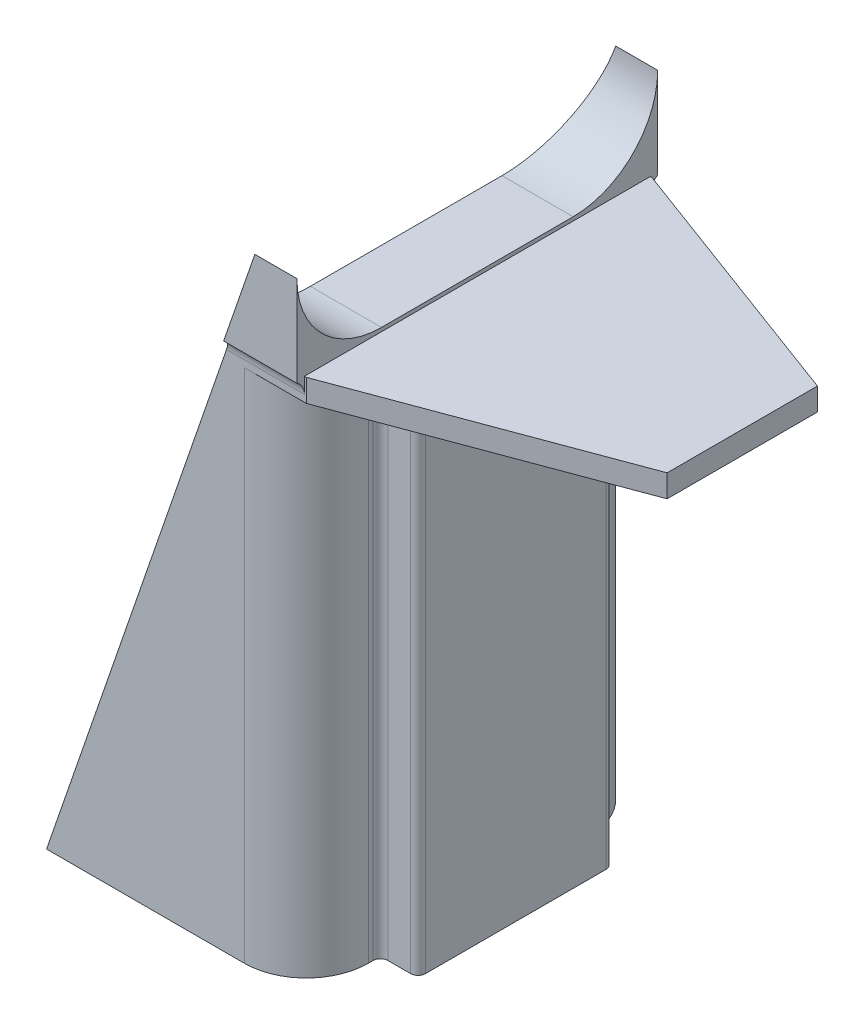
SolidWorks part; units mm, degrees
ref_plane "Alzado" through (0, 0, 0) normal (0, 0, 1) x (1, 0, 0)
ref_plane "Planta" through (0, 0, 0) normal (0, 1, 0) x (1, 0, 0)
ref_plane "Vista lateral" through (0, 0, 0) normal (1, 0, 0) x (0, 0, -1)
sketch "Croquis1" plane through (0, 0, 0) normal (0, 1, 0) x (1, 0, 0)
  line L12 (-39.5, 46) -> (39.5139, 46)
  line L13 (56, 28.8233) -> (56, 27.7301)
  line L14 (39.5, -46) -> (-39.5, -46)
  line L16 (-39.5, -46) -> (-39.5, -40)
  line L17 (-39.5, 40) -> (-39.5, 46)
  line L19 (50, -0.2699) -> (143.2716, -0.2699) construction
  line L20 (39.5, -40) -> (-39.5, -40)
  line L21 (132.78, -20.2699) -> (30.5649, -20.2699) construction
  line L23 (50, -29.5) -> (50, -20.2699)
  line L24 (132.78, 19.7301) -> (94.3511, 19.7301) construction
  line L25 (50, 19.7301) -> (50, -20.2699) construction
  line L26 (50, -20.2699) -> (60, -20.2699) construction
  line L27 (60, -20.2699) -> (60, 19.7301) construction
  line L28 (60, 19.7301) -> (50, 19.7301) construction
  line L29 (96.8866, 25.7301) -> (25.2245, 25.7301) construction
  line L30 (96.8866, -26.2699) -> (25.2245, -26.2699) construction
  line L31 (66, -30.1767) -> (66, 41.9813) construction
  line L32 (58, 25.7301) -> (64, 25.7301)
  line L33 (66, 23.7301) -> (66, -24.2699)
  line L34 (64, -26.2699) -> (58, -26.2699)
  line L35 (50, -20.2699) -> (60, -20.2699)
  line L36 (-39.5, -40) -> (39.5, -40)
  line L37 (60, -20.2699) -> (60, 19.7301)
  line L38 (60, 19.7301) -> (50, 19.7301)
  line L39 (50, 19.7301) -> (50, 28.9603)
  line L40 (56, -28.2699) -> (56, -29.5)
  line L41 (-39.5, 40) -> (39.5139, 40)
  line L42 (50, -20.2699) -> (50, -29.5)
  line L43 (50, 28.9603) -> (50, 19.7301)
  arc A0 (50, 28.9603) -> (39.5139, 40) centre (39.5139, 29.5) ccw
  arc A15 (50, -29.5) -> (39.5, -40) centre (39.5, -29.5) cw
  arc A20 (58, -26.2699) -> (56, -28.2699) centre (58, -28.2699) ccw
  arc A23 (56, 28.8233) -> (39.5139, 46) centre (39.5139, 29.5) ccw
  arc A24 (39.5, -46) -> (56, -29.5) centre (39.5, -29.5) ccw
  arc A25 (66, -24.2699) -> (64, -26.2699) centre (64, -24.2699) cw
  arc A26 (58, 25.7301) -> (56, 27.7301) centre (58, 27.7301) cw
  arc A27 (64, 25.7301) -> (66, 23.7301) centre (64, 23.7301) cw
  point P30 (56, -26.2699)
  point P35 (66, -26.2699)
  point P38 (56, 25.7301)
  point P41 (66, 25.7301)
  dimension "D8" = 10.5
  dimension "D9" = 16.5
  dimension "D12" = 20
  dimension "D2" = 6
  dimension "D6" = 16.5
  dimension "D7" = 10.5
  dimension "D15" = 6
  dimension "D16" = 2
  dimension "D1" = 6
  dimension "D3" = 92
  dimension "D4" = 6
  dimension "D5" = 95.5
  dimension "D10" = 40
  dimension "D11" = 50
  dimension "D13" = 10
  dimension "D14" = 6
extrude "Saliente-Extruir1" add sketch "Croquis1" along normal blind 60 contours L14 A24 L13 A23 L12 L17 L41 A0 L23 A15 L20 L16
sketch "Croquis2" plane through (0, 60, 0) normal (0, 1, 0) x (1, 0, 0)
  line L0 (-39.5, 46) -> (-39.5, -46)
  line L1 (-39.5, -46) -> (56, -46)
  line L3 (56, 46) -> (-39.5, 46)
  line L5 (126, -77.525) -> (126, 89.7791) construction
  line L6 (56, 0) -> (180.7602, 0) construction
  line L7 (172.6391, 20) -> (98.8111, 20) construction
  line L8 (172.6391, -20) -> (98.8111, -20) construction
  line L9 (56, 46) -> (126, 20)
  line L10 (126, 20) -> (126, -20)
  line L11 (126, -20) -> (56, -46)
  dimension "D2" = 20
extrude "Saliente-Extruir2" add sketch "Croquis2" along normal blind 6
sketch "Croquis3" plane through (60, 0, 0) normal (-1, 0, 0) x (0, 0, 1)
  line L0 (20.2699, 60) -> (20.2699, 0) construction
  line L1 (-19.7301, 60) -> (20.2699, 60)
  line L2 (-19.7301, 60) -> (-19.7301, 50)
  line L3 (-19.7301, 50) -> (20.2699, 50)
  line L4 (20.2699, 60) -> (20.2699, 50)
  dimension "D1" = 10
extrude "Cortar-Extruir1" cut sketch "Croquis3" against normal through all
sketch "Croquis4" plane through (-39.5, 0, 0) normal (-1, 0, 0) x (0, 0, 1)
  line L1 (-48, 65.3805) -> (-48, 89.5)
  line L2 (0, 64.5656) -> (0, 77.0059) construction
  line L3 (40, 60) -> (40, 0) construction
  line L4 (-46, 66) -> (-46, 0) construction
  line L5 (48, 65.3805) -> (48, 89.5)
  line L6 (-46, 61.8063) -> (-46, 66)
  line L7 (-46, 66) -> (46, 66)
  line L9 (46, 61.8063) -> (46, 66)
  line L11 (-25.5, 67) -> (25.5, 67)
  line L12 (-46, 66) -> (46, 66) construction
  arc A1 (46, 61.8063) -> (48, 65.3805) centre (50.1937, 61.8063) cw
  arc A2 (-46, 61.8063) -> (-48, 65.3805) centre (-50.1937, 61.8063) ccw
  arc A4 (-48, 89.5) -> (-25.5, 67) centre (-25.5, 89.5) ccw
  arc A5 (48, 89.5) -> (25.5, 67) centre (25.5, 89.5) cw
  point P24 (0, 67)
  dimension "D3" = 4.1937
  dimension "D4" = 40
  dimension "D5" = 51
  dimension "D7" = 45
  dimension "D1" = 48
  dimension "D6" = 1
extrude "Saliente-Extruir3" add sketch "Croquis4" against normal blind 95
sketch "Croquis5" plane through (0, 0, 46) normal (0, 0, 1) x (1, 0, 0)
  line L3 (-39.5, -91.8914) -> (-39.5, 89.5)
  line L8 (-39.5, 65.3805) -> (-39.5, 89.5) construction
  line L9 (-39.5, 89.5) -> (23.3824, 89.5)
  line L10 (55.5, 89.5) -> (-39.5, 89.5) construction
  line L11 (23.3824, 89.5) -> (-39.5, -91.8914)
  dimension "D1" = 19.12
extrude "Cortar-Extruir4" cut sketch "Croquis5" against normal through all both and the other way through all
sketch "Croquis6" plane through (0, 0, 46) normal (0, 0, 1) x (1, 0, 0)
  line L0 (-7.6443, 0) -> (8.9957, 0)
  line L1 (39.5, 0) -> (-7.6443, 0) construction
  line L2 (8.9957, 0) -> (39.813, 89.5)
  line L3 (55.5, 89.5) -> (23.3824, 89.5) construction
  line L4 (39.813, 89.5) -> (39.813, 4.7612) construction
  line L5 (-7.6443, 0) -> (23.3824, 89.5)
  line L6 (23.3824, 89.5) -> (39.813, 89.5)
  dimension "D1" = 16.64
  dimension "D2" = 19
extrude "Cortar-Extruir6" cut sketch "Croquis6" against normal through all both and the other way through all
sketch "Croquis7" plane through (0, 0, 0) normal (0, -1, 0) x (1, 0, 0)
  line L0 (8.9957, 46) -> (8.9957, 40)
  line L1 (8.9957, 40) -> (39.5, 40)
  line L2 (8.9957, 46) -> (39.5, 46)
  line L3 (8.9957, -40) -> (8.9957, -46)
  line L4 (8.9957, -46) -> (39.5139, -46)
  line L5 (8.9957, -40) -> (39.5139, -40)
  line L6 (56.0139, -29.5) -> (56, -27.7301)
  line L8 (50, -19.7301) -> (60, -19.7301)
  line L9 (60, -19.7301) -> (60, 20.2699)
  line L10 (60, 20.2699) -> (50, 20.2699)
  line L11 (50, 20.2699) -> (50, 29.5)
  line L12 (58, -25.7301) -> (64, -25.7301)
  line L13 (66, -23.7301) -> (66, 24.2699)
  line L14 (58, 26.2699) -> (64, 26.2699)
  line L15 (56, 28.2699) -> (56, 29.5)
  line L16 (50, -19.7301) -> (50, -28.9603)
  arc A0 (39.5, 46) -> (56, 29.5) centre (39.5, 29.5) cw
  arc A1 (56, 29.5) -> (39.5, 46) centre (39.5, 29.5) ccw construction
  arc A2 (39.5, 40) -> (50, 29.5) centre (39.5, 29.5) cw
  arc A3 (50, 29.5) -> (39.5, 40) centre (39.5, 29.5) ccw construction
  arc A4 (56, 28.2699) -> (58, 26.2699) centre (58, 28.2699) ccw
  arc A5 (56, 28.2699) -> (58, 26.2699) centre (58, 28.2699) ccw construction
  arc A6 (64, 26.2699) -> (66, 24.2699) centre (64, 24.2699) cw
  arc A7 (66, 24.2699) -> (64, 26.2699) centre (64, 24.2699) ccw construction
  arc A8 (66, -23.7301) -> (64, -25.7301) centre (64, -23.7301) cw
  arc A9 (64, -25.7301) -> (66, -23.7301) centre (64, -23.7301) ccw construction
  arc A10 (56, -27.7301) -> (58, -25.7301) centre (58, -27.7301) cw
  arc A11 (58, -25.7301) -> (56, -27.7301) centre (58, -27.7301) ccw construction
  arc A12 (56.0139, -29.5) -> (39.5139, -46) centre (39.5139, -29.5) cw
  arc A13 (39.5139, -46) -> (56, -28.8233) centre (39.5139, -29.5) ccw construction
  arc A14 (39.5139, -46) -> (56, -28.8233) centre (39.5139, -29.5) ccw construction
  arc A17 (39.5139, -40) -> (50, -28.9603) centre (39.5139, -29.5) ccw construction
  arc A19 (50, -28.9603) -> (39.5139, -40) centre (39.5139, -29.5) cw
extrude "Saliente-Extruir5" add sketch "Croquis7" along normal blind 106.9029
sketch "Croquis8" plane through (8.9957, 0, 0) normal (-1, 0, 0) x (0, 0, 1)
  line L0 (-46, 0) -> (-40, 0)
  line L2 (-40, 0) -> (-40, -106.9029)
  line L3 (-40, -106.9029) -> (-46, -106.9029)
  line L4 (-46, -106.9029) -> (-46, 0)
  line L5 (40, 0) -> (46, 0)
  line L6 (46, 0) -> (46, -106.9029)
  line L7 (46, -106.9029) -> (40, -106.9029)
  line L8 (40, -106.9029) -> (40, 0)
extrude "Saliente-Extruir6" add sketch "Croquis8" along normal blind 60
sketch "Croquis9" plane through (0, 0, 46) normal (0, 0, 1) x (1, 0, 0)
  line L0 (30.2773, 61.8063) -> (-27.8139, -106.9029)
  line L1 (39.5, -106.9029) -> (-51.0043, -106.9029) construction
  line L2 (8.9957, 0) -> (30.2773, 61.8063) construction
  line L3 (-27.8139, -106.9029) -> (-51.0043, -106.9029)
  line L4 (-51.0043, -106.9029) -> (-51.0043, 0)
  line L5 (-51.0043, 0) -> (8.9957, 0)
extrude "Cortar-Extruir7" cut sketch "Croquis9" against normal through all and the other way through all contours L0 M3 M4 M5
sketch "Croquis10" plane through (0, 0, 46) normal (0, 0, 1) x (1, 0, 0)
  line L0 (-27.8139, -106.9029) -> (-17.6074, -77.2609)
  line L1 (-27.8139, -106.9029) -> (30.2773, 61.8063) construction
  line L2 (-17.6074, -77.2609) -> (66, -77.2609)
  line L3 (66, 60) -> (66, -106.9029) construction
  line L4 (66, -77.2609) -> (66, -106.9029)
  line L5 (66, -106.9029) -> (-27.8139, -106.9029)
  dimension "D1" = 31.35
extrude "Cortar-Extruir8" cut sketch "Croquis10" against normal through all
sketch "Croquis11" plane through (0, 0, 46) normal (0, 0, 1) x (1, 0, 0)
  line L0 (-17.6074, -77.2609) -> (-13.1074, -77.2609)
  line L1 (39.5, -77.2609) -> (-17.6074, -77.2609) construction
  line L2 (-13.1074, -77.2609) -> (44.313, 89.5)
  line L4 (44.313, 89.5) -> (39.813, 89.5)
  line L5 (39.813, 89.5) -> (-17.6074, -77.2609)
  dimension "D1" = 4.5
  dimension "D2" = 4.5
extrude "Cortar-Extruir9" cut sketch "Croquis11" against normal through all both and the other way through all
